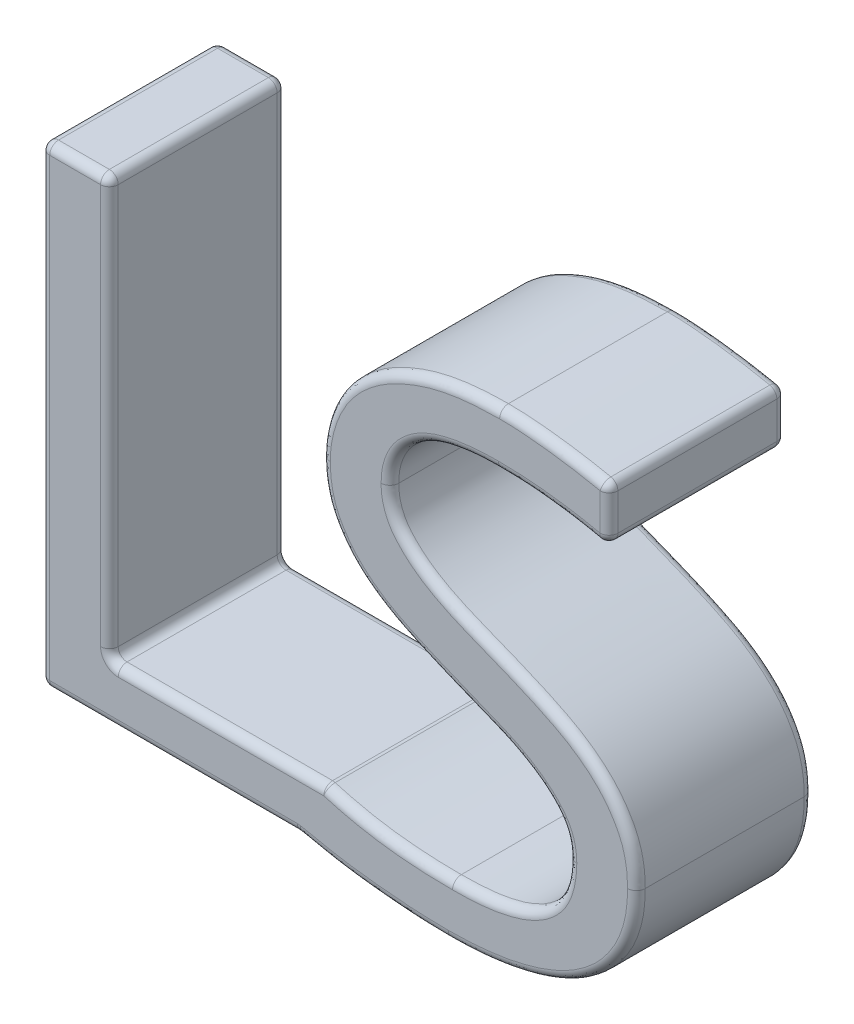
SolidWorks part; units mm, degrees
ref_plane "Ebene vorne" through (0, 0, 0) normal (0, 0, 1) x (1, 0, 0)
ref_plane "Ebene oben" through (0, 0, 0) normal (0, 1, 0) x (1, 0, 0)
ref_plane "Ebene rechts" through (0, 0, 0) normal (1, 0, 0) x (0, 0, -1)
sketch "Skizze1"
extrude "Linear austragen1" add sketch "Skizze1" along normal blind 20
sketch "Skizze4"
extrude "Linear austragen3" add sketch "Skizze4" along normal blind 20
sketch "Skizze6" plane through (0, 0, 20) normal (0, 0, 1) x (1, 0, 0)
  line L8 (9.3043, 0) -> (40.2934, 0)
  line L9 (40.2934, 0) -> (40.2934, -0.3768)
  line L10 (73.634, 45.3695) -> (73.634, 51.5724)
  line L11 (40.2934, 6.6014) -> (40.2934, 6.2029)
  line L12 (40.2934, 6.2029) -> (17.058, 6.2029)
  line L13 (17.058, 6.2029) -> (17.058, 53.5)
  line L14 (17.058, 53.5) -> (9.3043, 53.5)
  line L15 (9.3043, 53.5) -> (9.3043, 0)
  line L16 (10.3043, 0) -> (38.3332, 0)
  line L18 (73.634, 46.6134) -> (73.634, 50.7647)
  line L20 (41.331, 6.2029) -> (18.058, 6.2029)
  line L21 (17.058, 7.2029) -> (17.058, 52.5)
  line L22 (16.058, 53.5) -> (10.3043, 53.5)
  line L23 (9.3043, 52.5) -> (9.3043, 1)
  arc A0 (10.3043, 53.5) -> (9.3043, 52.5) centre (10.3043, 52.5) ccw
  arc A1 (17.058, 52.5) -> (16.058, 53.5) centre (16.058, 52.5) ccw
  arc A2 (73.634, 50.7647) -> (72.8416, 51.743) centre (72.634, 50.7647) ccw
  arc A3 (72.4226, 45.636) -> (73.634, 46.6134) centre (72.634, 46.6134) ccw
  arc A4 (41.331, 6.2029) -> (41.629, 6.1575) centre (41.331, 5.2029) cw
  arc A5 (38.5171, -0.0171) -> (38.3332, 0) centre (38.3332, -1) ccw
  arc A6 (10.3043, 0) -> (9.3043, 1) centre (10.3043, 1) cw
  arc A7 (18.058, 6.2029) -> (17.058, 7.2029) centre (18.058, 7.2029) cw
  spline S10 degree 3 poles (-654.6561, -2917.4358) (-22.783, 54.9761) (5.7693, 5.6638) (43.4629, -0.9879) (45.2414, -1.2367) (47.1366, -1.4518) (49.1235, -1.6453) (51.1869, -1.8063) (97.4737, -3.9443) (144.2656, 45.2592) (118.1657, -2999.5023) knots -7.206982 -7.206982 -7.206982 -7.206982 0.099024 0.208835 0.327695 0.452561 0.584375 0.720738 0.860034 9.70573 9.70573 9.70573 9.70573 only from (40.2934, -0.3768) to (55.4251, -1.9276)
  spline S11 degree 3 poles (77.839, -3000.5636) (-19.7688, 60.2728) (21.2367, -5.0231) (59.93, -1.7052) (62.0515, -1.4232) (64.0639, -1.0126) (65.9574, -0.4845) (67.715, 0.1705) (69.3416, 0.9286) (70.815, 1.8295) (72.1387, 2.8531) (73.3337, 3.9773) (74.3344, 5.2553) (75.2105, 6.6246) (75.8915, 8.1346) (76.3871, 9.7578) (80.9119, 36.3654) (4.4348, 68.8348) (3071.709, -148.801) knots -3.716216 -3.716216 -3.716216 -3.716216 0.078383 0.153709 0.226173 0.295687 0.362182 0.425658 0.486032 0.544218 0.600672 0.6558 0.710387 0.765135 0.820579 0.878067 0.937147 3.552448 3.552448 3.552448 3.552448 only from (55.4251, -1.9276) to (76.7355, 13.3253)
  spline S12 degree 3 poles (3070.2935, 202.0075) (7.5268, -36.3137) (80.3671, -6.9737) (76.4594, 16.2896) (76.0986, 17.6315) (75.5455, 18.8512) (74.8988, 19.99) (74.1487, 21.0501) (73.3079, 22.0424) (72.3673, 22.9451) (71.3651, 23.7986) (70.275, 24.5712) (69.127, 25.3037) (67.4888, 26.1775) (65.3781, 27.1954) (62.7882, 28.2896) (60.213, 29.3414) (57.6838, 30.3116) (55.3236, 31.3498) (53.5274, 32.3392) (52.2574, 33.2074) (51.4158, 33.8856) (50.6761, 34.6084) (50.004, 35.3515) (49.4764, 36.1852) (49.0991, 37.0943) (45.2345, 52.8259) (116.6141, 77.0467) (-2935.3533, -264.9737) knots -1.627224 -1.627224 -1.627224 -1.627224 0.038159 0.073752 0.107785 0.14032 0.172196 0.204253 0.23594 0.267949 0.300283 0.332928 0.366388 0.400636 0.469761 0.539128 0.607921 0.674889 0.738869 0.797933 0.82577 0.852234 0.877506 0.90199 0.925949 0.949841 0.974327 2.112611 2.112611 2.112611 2.112611 only from (76.7355, 13.3253) to (48.8224, 39.1061)
  spline S13 degree 3 poles (-2947.5556, 177.9129) (101.5193, 3.6419) (46.3846, 23.8916) (48.981, 40.8002) (49.2333, 41.5812) (49.5581, 42.3228) (49.9732, 43.0217) (50.4874, 43.6687) (51.1032, 44.2638) (51.8038, 44.8243) (52.6112, 45.3194) (53.5135, 45.7601) (54.5259, 46.1211) (55.6428, 46.4053) (56.8608, 46.6349) (58.1833, 46.8047) (90.7712, 48.9201) (124.4378, -1.0254) (67.0441, 3045.9667) knots -2.966524 -2.966524 -2.966524 -2.966524 0.053333 0.104279 0.15387 0.203207 0.252293 0.302307 0.354084 0.408834 0.466299 0.527161 0.592434 0.662753 0.738036 0.819313 0.906785 6.715113 6.715113 6.715113 6.715113 only from (48.8224, 39.1061) to (61.1071, 46.9203)
  spline S14 degree 3 poles (104.7507, 3044.9091) (-25.1721, -24.3791) (22.7781, 51.2054) (67.2917, 46.5389) (115.9782, 39.3815) (149.3431, -43.891) (760.5459, 2963.6918) knots -9.863613 -9.863613 -9.863613 -9.863613 0.239575 0.487847 0.742647 11.904659 11.904659 11.904659 11.904659 only from (61.1071, 46.9203) to (73.634, 45.3695)
  spline S15 degree 3 poles (782.5681, 2965.2821) (138.1121, -2.5161) (108.7834, 45.0438) (70.6485, 52.1741) (69.0617, 52.4409) (67.4454, 52.6673) (65.8264, 52.8655) (64.2343, 53.0039) (34.8782, 55.1143) (4.0753, 2.2399) (85.8794, 3052.1697) knots -8.929332 -8.929332 -8.929332 -8.929332 0.11679 0.241934 0.371507 0.50255 0.633217 0.762518 0.88573 7.686734 7.686734 7.686734 7.686734 only from (73.634, 51.5724) to (61.2403, 53.1232)
  spline S16 degree 3 poles (46.6804, 3051.6742) (140.4394, -11.5111) (97.2031, 56.6907) (56.3568, 52.8476) (54.1559, 52.4504) (52.1368, 51.8958) (50.3096, 51.1972) (48.6373, 50.4274) (47.152, 49.5304) (45.8296, 48.5471) (44.6865, 47.4723) (43.6896, 46.3325) (42.878, 45.0945) (42.2112, 43.8032) (41.7021, 42.4639) (41.3405, 41.1079) (37.6262, 19.0088) (105.0184, -8.6712) (-2952.2115, 229.9863) knots -4.137816 -4.137816 -4.137816 -4.137816 0.091425 0.176702 0.256377 0.330973 0.400868 0.465959 0.528122 0.586584 0.642346 0.696082 0.748569 0.800669 0.851659 0.901871 0.950996 3.247926 3.247926 3.247926 3.247926 only from (61.2403, 53.1232) to (41.0688, 38.3671)
  spline S17 degree 3 poles (-2952.7862, -144.8322) (110.2123, 87.2078) (37.4425, 58.3731) (41.3449, 35.4465) (41.7105, 34.1253) (42.2376, 32.9084) (42.9112, 31.8073) (43.6404, 30.7575) (44.4903, 29.7961) (45.7395, 28.5954) (47.5275, 27.262) (49.9019, 25.9182) (52.4336, 24.7468) (55.0143, 23.6411) (57.5955, 22.5995) (60.1107, 21.6008) (62.4826, 20.6061) (64.2631, 19.6115) (65.5356, 18.7651) (66.3742, 18.0919) (67.1339, 17.3958) (67.7806, 16.6362) (68.3309, 15.8277) (68.7062, 14.9211) (72.5678, -0.8031) (1.2313, -25.2347) (3052.229, 325.5855) knots -1.612973 -1.612973 -1.612973 -1.612973 0.037789 0.073002 0.10695 0.139284 0.170983 0.202569 0.233991 0.265983 0.330991 0.398766 0.468045 0.537826 0.60703 0.674507 0.738627 0.797635 0.825469 0.851903 0.877336 0.901771 0.925783 0.949542 0.974174 2.119545 2.119545 2.119545 2.119545 only from (41.0688, 38.3671) to (68.9818, 12.9134)
  spline S18 degree 3 poles (3064.1953, -150.1598) (14.055, 52.5523) (71.506, 29.7362) (68.8173, 10.9742) (68.601, 10.079) (68.2894, 9.2418) (67.868, 8.4646) (67.3492, 7.7449) (66.7027, 7.0998) (65.9653, 6.5011) (65.105, 5.983) (64.1452, 5.5208) (63.0693, 5.1324) (61.879, 4.8273) (60.5706, 4.5621) (59.131, 4.4095) (27.015, 2.0108) (-7.1204, 59.0101) (90.3775, -2994.5991) knots -3.022748 -3.022748 -3.022748 -3.022748 0.056492 0.110045 0.16116 0.211288 0.259958 0.309591 0.360069 0.413262 0.469112 0.52871 0.592368 0.661298 0.735429 0.816888 0.9048 6.15542 6.15542 6.15542 6.15542 only from (68.9818, 12.9134) to (55.9097, 4.2753)
  spline S19 degree 3 poles (98.4786, -2993.844) (140.4228, 60.3916) (95.3876, 1.923) (51.3314, 4.4184) (49.2172, 4.6063) (47.2284, 4.8735) (45.3574, 5.213) (43.5858, 5.6193) (13.9472, 13.2127) (3.0786, 80.5737) (-913.0469, -2836.9398) knots -7.916609 -7.916609 -7.916609 -7.916609 0.149701 0.291191 0.425395 0.551006 0.670543 0.784855 0.894704 6.452454 6.452454 6.452454 6.452454 only from (55.9097, 4.2753) to (40.2934, 6.6014)
  spline S20 degree 3 poles (38.5171, -0.0171) (39.6053, -0.2207) (41.2285, -0.5936) (43.4629, -0.9879) (45.2414, -1.2367) (47.1366, -1.4518) (49.1235, -1.6453) (51.1869, -1.8063) (53.296, -1.9037) (54.7143, -1.9196) (55.4251, -1.9276) knots -0.118953 -0.118953 -0.118953 -0.118953 0.099024 0.208835 0.327695 0.452561 0.584375 0.720738 0.860034 1 1 1 1
  spline S21 degree 3 poles (55.4251, -1.9276) (56.1968, -1.9167) (57.7102, -1.8955) (59.93, -1.7052) (62.0515, -1.4232) (64.0639, -1.0126) (65.9574, -0.4845) (67.715, 0.1705) (69.3416, 0.9286) (70.815, 1.8295) (72.1387, 2.8531) (73.3337, 3.9773) (74.3344, 5.2553) (75.2105, 6.6246) (75.8915, 8.1346) (76.3871, 9.7578) (76.6843, 11.5053) (76.718, 12.7062) (76.7355, 13.3253) knots 0 0 0 0 0.078383 0.153709 0.226173 0.295687 0.362182 0.425658 0.486032 0.544218 0.600672 0.6558 0.710387 0.765135 0.820579 0.878067 0.937147 1 1 1 1
  spline S22 degree 3 poles (76.7355, 13.3253) (76.7241, 13.8433) (76.7021, 14.8444) (76.4594, 16.2896) (76.0986, 17.6315) (75.5455, 18.8512) (74.8988, 19.99) (74.1487, 21.0501) (73.3079, 22.0424) (72.3673, 22.9451) (71.3651, 23.7986) (70.275, 24.5712) (69.127, 25.3037) (67.4888, 26.1775) (65.3781, 27.1954) (62.7882, 28.2896) (60.213, 29.3414) (57.6838, 30.3116) (55.3236, 31.3498) (53.5274, 32.3392) (52.2574, 33.2074) (51.4158, 33.8856) (50.6761, 34.6084) (50.004, 35.3515) (49.4764, 36.1852) (49.0991, 37.0943) (48.8579, 38.076) (48.8344, 38.7573) (48.8224, 39.1061) knots 0 0 0 0 0.038159 0.073752 0.107785 0.14032 0.172196 0.204253 0.23594 0.267949 0.300283 0.332928 0.366388 0.400636 0.469761 0.539128 0.607921 0.674889 0.738869 0.797933 0.82577 0.852234 0.877506 0.90199 0.925949 0.949841 0.974327 1 1 1 1
  spline S23 degree 3 poles (48.8224, 39.1061) (48.8328, 39.3972) (48.853, 39.9664) (48.981, 40.8002) (49.2333, 41.5812) (49.5581, 42.3228) (49.9732, 43.0217) (50.4874, 43.6687) (51.1032, 44.2638) (51.8038, 44.8243) (52.6112, 45.3194) (53.5135, 45.7601) (54.5259, 46.1211) (55.6428, 46.4053) (56.8608, 46.6349) (58.1833, 46.8047) (59.6115, 46.8974) (60.5981, 46.9125) (61.1071, 46.9203) knots 0 0 0 0 0.053333 0.104279 0.15387 0.203207 0.252293 0.302307 0.354084 0.408834 0.466299 0.527161 0.592434 0.662753 0.738036 0.819313 0.906785 1 1 1 1
  spline S24 degree 3 poles (61.1071, 46.9203) (62.1175, 46.9023) (64.1749, 46.8656) (67.2917, 46.5389) (70.0564, 46.1324) (71.766, 45.778) (72.4226, 45.636) knots 0 0 0 0 0.239575 0.487847 0.742647 0.901966 0.901966 0.901966 0.901966
  spline S25 degree 3 poles (72.8416, 51.743) (72.6294, 51.788) (71.9061, 51.9389) (70.6485, 52.1741) (69.0617, 52.4409) (67.4454, 52.6673) (65.8264, 52.8655) (64.2343, 53.0039) (62.7077, 53.1137) (61.717, 53.1201) (61.2403, 53.1232) knots 0.064777 0.064777 0.064777 0.064777 0.11679 0.241934 0.371507 0.50255 0.633217 0.762518 0.88573 1 1 1 1
  spline S26 degree 3 poles (61.2403, 53.1232) (60.3878, 53.1057) (58.74, 53.0719) (56.3568, 52.8476) (54.1559, 52.4504) (52.1368, 51.8958) (50.3096, 51.1972) (48.6373, 50.4274) (47.152, 49.5304) (45.8296, 48.5471) (44.6865, 47.4723) (43.6896, 46.3325) (42.878, 45.0945) (42.2112, 43.8032) (41.7021, 42.4639) (41.3405, 41.1079) (41.1105, 39.7398) (41.0827, 38.8243) (41.0688, 38.3671) knots 0 0 0 0 0.091425 0.176702 0.256377 0.330973 0.400868 0.465959 0.528122 0.586584 0.642346 0.696082 0.748569 0.800669 0.851659 0.901871 0.950996 1 1 1 1
  spline S27 degree 3 poles (41.0688, 38.3671) (41.0802, 37.8572) (41.1022, 36.8721) (41.3449, 35.4465) (41.7105, 34.1253) (42.2376, 32.9084) (42.9112, 31.8073) (43.6404, 30.7575) (44.4903, 29.7961) (45.7395, 28.5954) (47.5275, 27.262) (49.9019, 25.9182) (52.4336, 24.7468) (55.0143, 23.6411) (57.5955, 22.5995) (60.1107, 21.6008) (62.4826, 20.6061) (64.2631, 19.6115) (65.5356, 18.7651) (66.3742, 18.0919) (67.1339, 17.3958) (67.7806, 16.6362) (68.3309, 15.8277) (68.7062, 14.9211) (68.9463, 13.9435) (68.9698, 13.2621) (68.9818, 12.9134) knots 0 0 0 0 0.037789 0.073002 0.10695 0.139284 0.170983 0.202569 0.233991 0.265983 0.330991 0.398766 0.468045 0.537826 0.60703 0.674507 0.738627 0.797635 0.825469 0.851903 0.877336 0.901771 0.925783 0.949542 0.974174 1 1 1 1
  spline S28 degree 3 poles (68.9818, 12.9134) (68.9722, 12.5777) (68.9534, 11.9239) (68.8173, 10.9742) (68.601, 10.079) (68.2894, 9.2418) (67.868, 8.4646) (67.3492, 7.7449) (66.7027, 7.0998) (65.9653, 6.5011) (65.105, 5.983) (64.1452, 5.5208) (63.0693, 5.1324) (61.879, 4.8273) (60.5706, 4.5621) (59.131, 4.4095) (57.5633, 4.2924) (56.4753, 4.2812) (55.9097, 4.2753) knots 0 0 0 0 0.056492 0.110045 0.16116 0.211288 0.259958 0.309591 0.360069 0.413262 0.469112 0.52871 0.592368 0.661298 0.735429 0.816888 0.9048 1 1 1 1
  spline S29 degree 3 poles (55.9097, 4.2753) (55.118, 4.2807) (53.578, 4.2911) (51.3314, 4.4184) (49.2172, 4.6063) (47.2284, 4.8735) (45.3574, 5.213) (43.5858, 5.6193) (42.3518, 5.9355) (41.7127, 6.1314) (41.629, 6.1575) knots 0 0 0 0 0.149701 0.291191 0.425395 0.551006 0.670543 0.784855 0.894704 0.911289 0.911289 0.911289 0.911289
  dimension "D2" = 1
  dimension "D1" = 0
delete or keep bodies "Körper-Löschen1" type delete bodies bodies 103
extrude "Linear austragen5" add sketch "Skizze6" along normal blind 20
fillet "Verrundung2" radius 1 48 edges at (73.2619, 45.8351, 20) (73.634, 48.6891, 20) (73.4111, 51.3942, 20) (41.4817, 6.1915, 20) (29.6945, 6.2029, 20) (17.3509, 6.4958, 20) (17.058, 29.8514, 20) (16.7651, 53.2071, 20) (13.1812, 53.5, 20) (9.5972, 53.2071, 20) (9.3043, 26.75, 20) (9.5972, 0.2929, 20) (24.3188, 0, 20) (38.4256, -0.0043, 20) (38.4256, -0.0043, 40) (24.3188, 0, 40) (9.5972, 0.2929, 40) (9.3043, 26.75, 40) (9.5972, 53.2071, 40) (13.1812, 53.5, 40) (16.7651, 53.2071, 40) (17.058, 29.8514, 40) (17.3509, 6.4958, 40) (29.6945, 6.2029, 40) (41.4817, 6.1915, 40) (73.4111, 51.3942, 40) (73.634, 48.6891, 40) (73.2619, 45.8351, 40)
